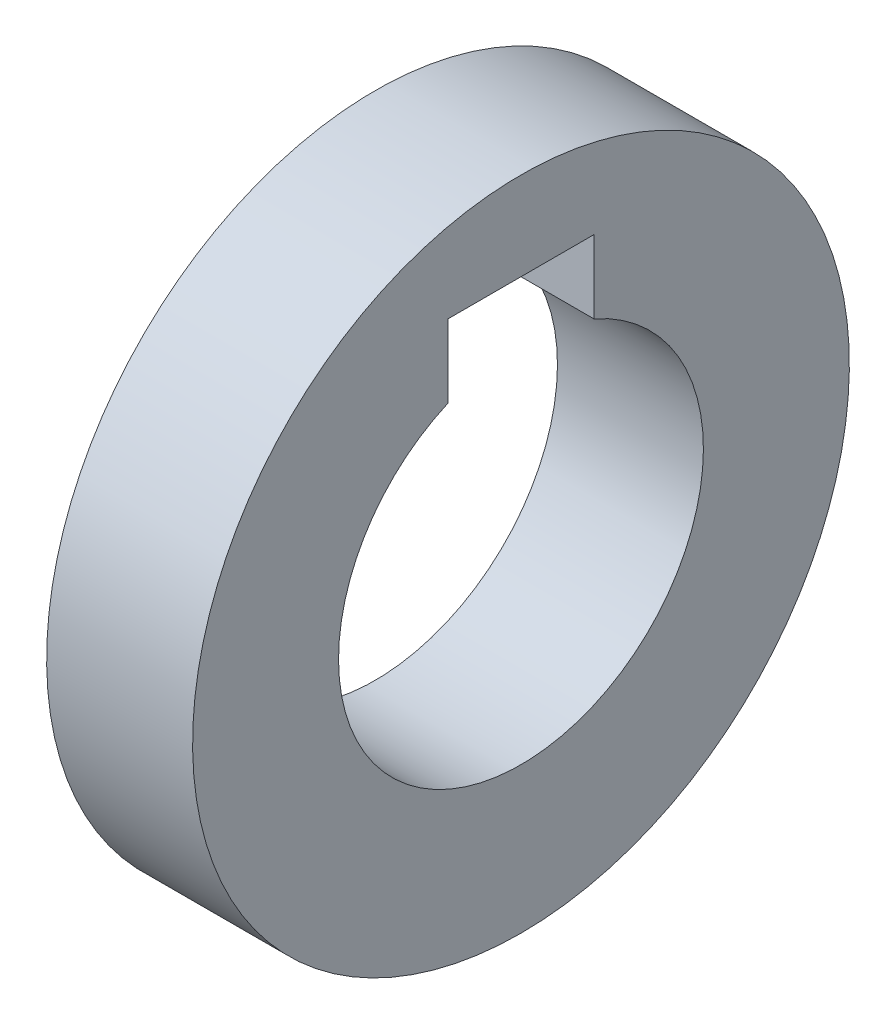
SolidWorks part; units mm, degrees
ref_plane "Front Plane" through (0, 0, 0) normal (0, 0, 1) x (1, 0, 0)
ref_plane "Top Plane" through (0, 0, 0) normal (0, 1, 0) x (1, 0, 0)
ref_plane "Right Plane" through (0, 0, 0) normal (1, 0, 0) x (0, 0, -1)
sketch "Sketch2" plane through (0, 0, 0) normal (0, 0, 1) x (1, 0, 0)
  line L0 (-1, 2.5) -> (1, 2.5)
  line L1 (-1, 0) -> (1, 0) construction
  line L2 (-1, 2.5) -> (-1, 4.5)
  line L3 (-1, 4.5) -> (1, 4.5)
  line L4 (1, 4.5) -> (1, 2.5)
  point P5 (0, 0)
  point P6 (0, 2.5)
  dimension "D1" = 2
  dimension "D2" = 2.5
  dimension "D3" = 2
revolve "Revolve1" add sketch "Sketch2" angle 360 about L1
sketch "Sketch3" plane through (1, 0, 0) normal (1, 0, 0) x (0, 0, -1)
  line L0 (-1, 0) -> (1, 0) construction
  line L1 (-1, 0) -> (-1, 2.2913) construction
  line L2 (1, 0) -> (1, 2.2913) construction
  line L3 (-1, 2.2913) -> (-1, 3.2913)
  line L4 (-1, 3.2913) -> (1, 3.2913)
  line L5 (1, 3.2913) -> (1, 2.2913)
  line L6 (1, 2.2913) -> (-1, 2.2913)
  circle A0 centre (0, 0) radius 2.5 construction
  dimension "D1" = 2
  dimension "D2" = 1
extrude "Cut-Extrude1" cut sketch "Sketch3" against normal blind 2
